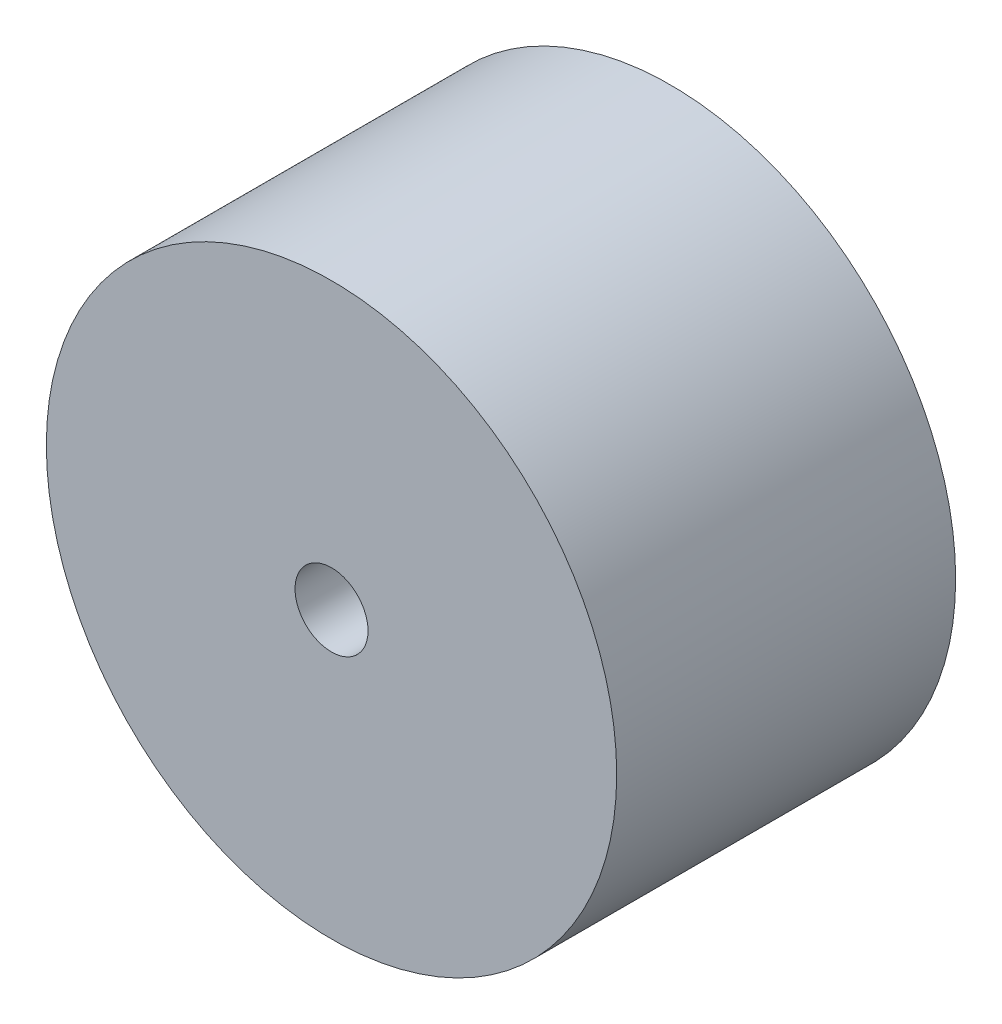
SolidWorks part; units mm, degrees
ref_plane "Front Plane" through (0, 0, 0) normal (0, 0, 1) x (1, 0, 0)
ref_plane "Top Plane" through (0, 0, 0) normal (0, 1, 0) x (1, 0, 0)
ref_plane "Right Plane" through (0, 0, 0) normal (1, 0, 0) x (0, 0, -1)
sketch "Sketch1" plane through (0, 0, 0) normal (0, 0, 1) x (1, 0, 0)
  circle A0 centre (0, 0) radius 3.2
  circle A1 centre (0, 0) radius 25
  dimension "D1" = 6.4
  dimension "D2" = 50
extrude "Boss-Extrude1" add sketch "Sketch1" along normal blind 29.7137
